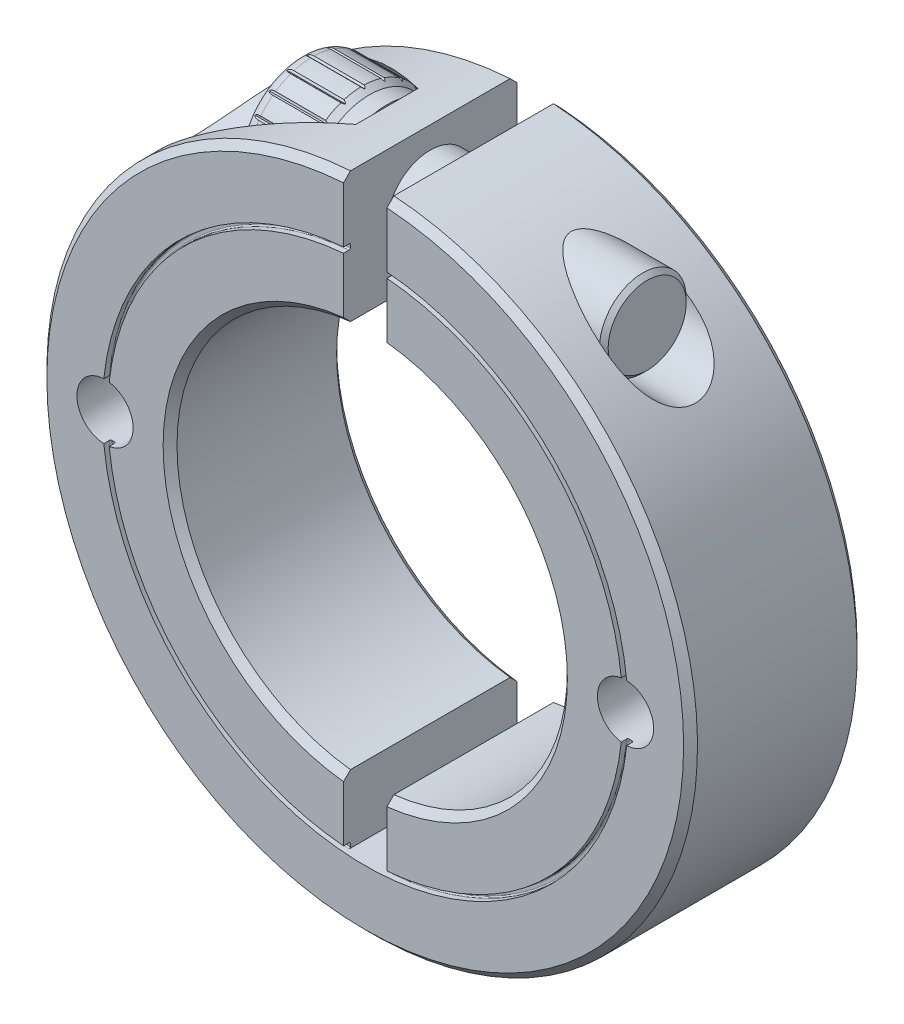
SolidWorks part; units mm, degrees
other "Cut-Extrude7"
other "CirPattern1"
ref_plane "Front Plane" through (0, 0, 0) normal (0, 0, 1) x (1, 0, 0)
ref_plane "Top Plane" through (0, 0, 0) normal (0, 1, 0) x (1, 0, 0)
ref_plane "Right Plane" through (0, 0, 0) normal (1, 0, 0) x (0, 0, -1)
imported_body "Imported1"
imported_body "Imported2"
sketch "Sketch1" plane through (0, 0, 0) normal (0, 0, 1) x (1, 0, 0)
  line L0 (0, 0) -> (0, 10.9607) construction
  circle A0 centre (-19.05, 0) radius 2.0574
  circle A1 centre (19.05, 0) radius 2.0574
  dimension "D1" = 4.1148
  dimension "D2" = 38.1
extrude "Cut-Extrude1" cut sketch "Sketch1" against normal mid plane 20.32
